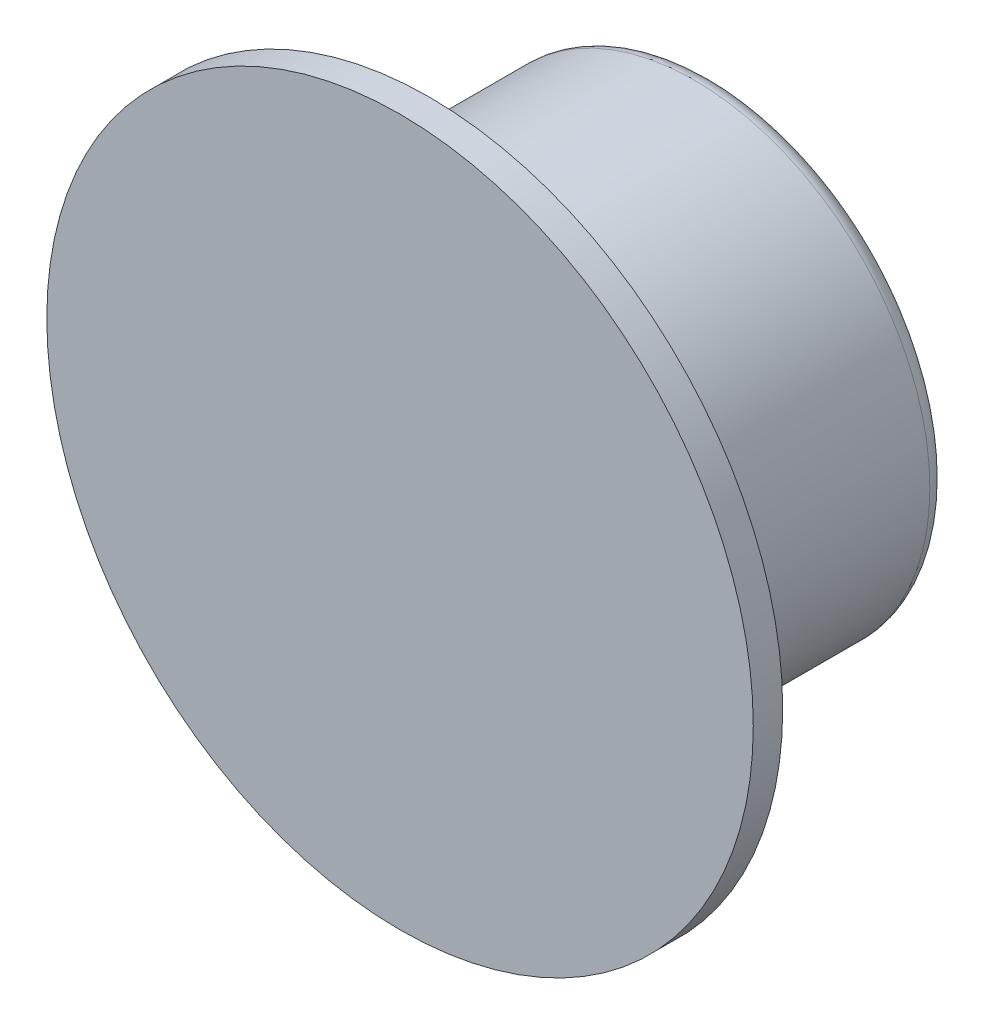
SolidWorks part; units mm, degrees
ref_plane "Front Plane" through (0, 0, 0) normal (0, 0, 1) x (1, 0, 0)
ref_plane "Top Plane" through (0, 0, 0) normal (0, 1, 0) x (1, 0, 0)
ref_plane "Right Plane" through (0, 0, 0) normal (1, 0, 0) x (0, 0, -1)
sketch "Sketch1" plane through (0, 0, 0) normal (1, 0, 0) x (0, 0, -1)
  line L0 (0, 0) -> (50, 0) construction
  line L1 (0, 0) -> (0, 60)
  line L2 (0, 60) -> (5, 60)
  line L3 (5, 60) -> (5, 40)
  line L4 (5, 40) -> (50, 40)
  line L5 (53, 37) -> (53, 5)
  line L6 (52, 4) -> (44, 4)
  line L7 (44, 4) -> (41.6906, 0)
  line L8 (53, 5) -> (52, 4)
  line L9 (0, 0) -> (41.6906, 0)
  arc A0 (50, 40) -> (53, 37) centre (50, 37) cw
  point P9 (53, 40)
  dimension "D5" = 3
  dimension "D1" = 40
  dimension "D2" = 60
  dimension "D3" = 5
  dimension "D4" = 48
  dimension "D6" = 45
  dimension "D7" = 1
  dimension "D8" = 60
  dimension "D9" = 4
  dimension "D10" = 9
revolve "Revolve1" add sketch "Sketch1" angle 360 about L0
